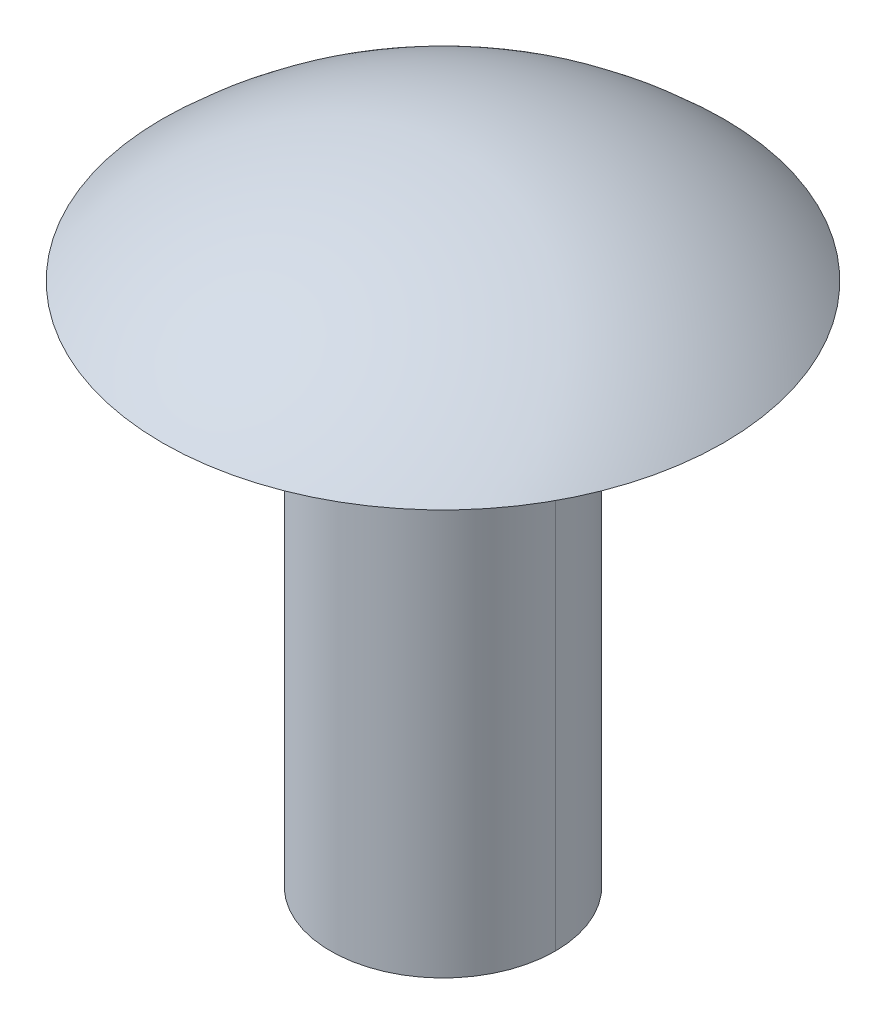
SolidWorks part; units mm, degrees
ref_plane "Front Plane" through (0, 0, 0) normal (0, 0, 1) x (1, 0, 0)
ref_plane "Top Plane" through (0, 0, 0) normal (0, 1, 0) x (1, 0, 0)
ref_plane "Right Plane" through (0, 0, 0) normal (1, 0, 0) x (0, 0, -1)
sketch "Sketch1" plane through (0, 0, 0) normal (0, 1, 0) x (1, 0, 0)
  circle A0 centre (0, 0) radius 4.7625
  dimension "D1" = 9.525
extrude "Boss-Extrude1" add sketch "Sketch1" against normal blind 22.2377
sketch "head diameter" plane through (0, 0, 0) normal (0, 1, 0) x (1, 0, 0)
  circle A0 centre (0, 0) radius 11.8999
  circle A1 centre (0, 0) radius 4.7625 construction
  point P4 (11.8999, 0)
  dimension "D1" = 23.7998
sketch "Sketch3" plane through (0, 0, 0) normal (0, 0, 1) x (1, 0, 0)
  line L0 (0, 4.7498) -> (-9.5218, 4.7498) construction
  line L1 (0, 4.7498) -> (0, 0)
  line L2 (0, 0) -> (11.8999, 0)
  arc A0 (0, 4.7498) -> (11.8999, 0) centre (0, -12.5318) cw
  dimension "D2" = 17.2816
  dimension "D1" = 4.7498
  dimension "D3" = 11.8999
revolve "Revolve1" add sketch "Sketch3" angle 360 about L1
sketch "Sketch5" plane through (0, 0, 0) normal (0, 1, 0) x (1, 0, 0)
  line L0 (-11.8999, 0) -> (11.8999, 0)
  circle A0 centre (0, 0) radius 11.8999 construction
